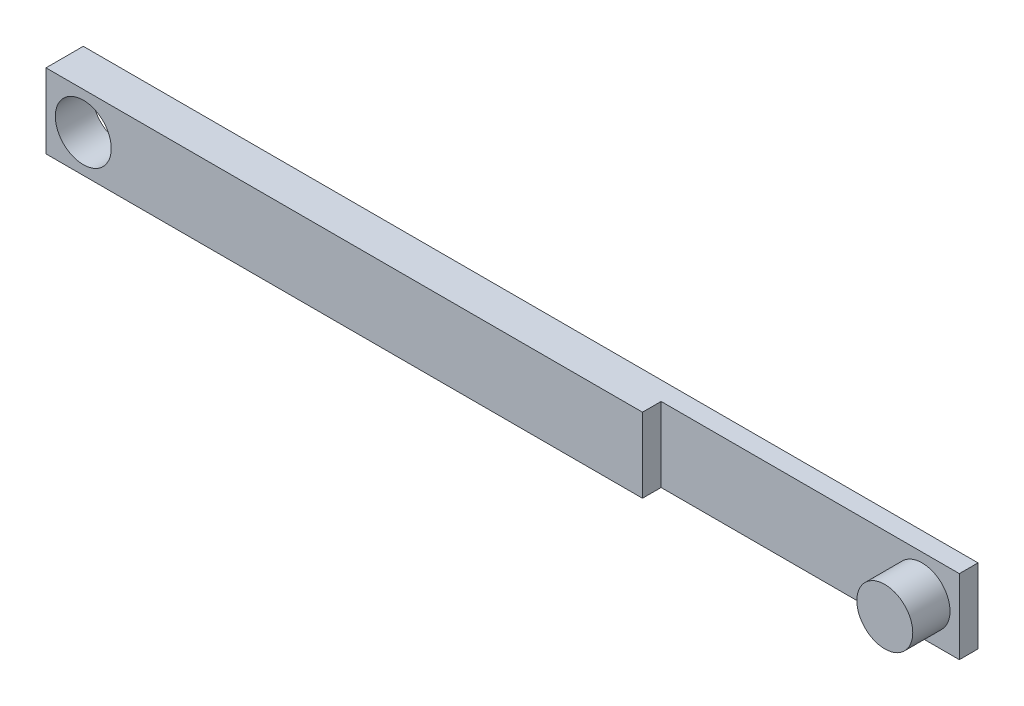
SolidWorks part; units mm, degrees
ref_plane "正面" through (0, 0, 0) normal (0, 0, 1) x (1, 0, 0)
ref_plane "平面" through (0, 0, 0) normal (0, 1, 0) x (1, 0, 0)
ref_plane "右側面" through (0, 0, 0) normal (1, 0, 0) x (0, 0, -1)
sketch "ｽｹｯﾁ1" plane through (0, 0, 0) normal (0, 0, 1) x (1, 0, 0)
  line L1 (0, 0) -> (240, 0)
  line L2 (0, 0) -> (0, 20)
  line L3 (0, 20) -> (240, 20)
  line L4 (240, 0) -> (240, 20)
  dimension "D1" = 240
  dimension "D2" = 20
extrude "押し出し1" add sketch "ｽｹｯﾁ1" along normal blind 10
sketch "ｽｹｯﾁ2" plane through (0, 0, 10) normal (0, 0, 1) x (1, 0, 0)
  line L0 (240, 20) -> (0, 20) construction
  line L1 (0, 20) -> (0, 0) construction
  circle A0 centre (10, 10) radius 7.5
  dimension "D1" = 15
  dimension "D2" = 10
  dimension "D3" = 10
extrude "押し出し2" cut sketch "ｽｹｯﾁ2" against normal through all
sketch "ｽｹｯﾁ3" plane through (0, 0, 10) normal (0, 0, 1) x (1, 0, 0)
  line L0 (0, 0) -> (240, 0) construction
  line L1 (240, 20) -> (160, 20)
  line L2 (240, 20) -> (240, 0)
  line L3 (240, 0) -> (160, 0)
  line L4 (160, 20) -> (160, 0)
  dimension "D1" = 80
extrude "押し出し3" cut sketch "ｽｹｯﾁ3" against normal blind 5
sketch "ｽｹｯﾁ4" plane through (0, 0, 5) normal (0, 0, 1) x (1, 0, 0)
  line L0 (240, 20) -> (160, 20) construction
  line L3 (240, 0) -> (240, 20) construction
  circle A0 centre (230, 10) radius 7.5
  dimension "D1" = 15
  dimension "D2" = 10
  dimension "D3" = 10
extrude "押し出し4" add sketch "ｽｹｯﾁ4" along normal blind 10
